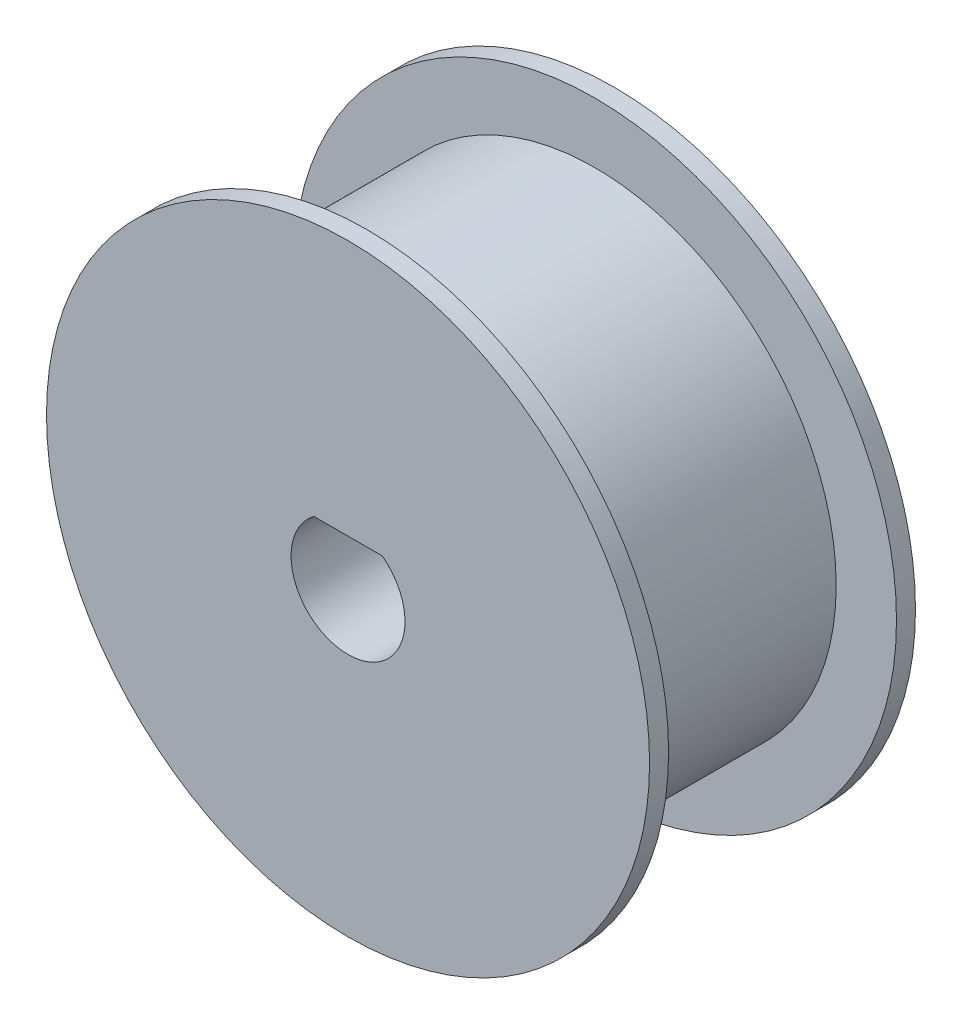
SolidWorks part; units mm, degrees
ref_plane "Front Plane" through (0, 0, 0) normal (0, 0, 1) x (1, 0, 0)
ref_plane "Top Plane" through (0, 0, 0) normal (0, 1, 0) x (1, 0, 0)
ref_plane "Right Plane" through (0, 0, 0) normal (1, 0, 0) x (0, 0, -1)
sketch "Sketch1" plane through (0, 0, 0) normal (0, 0, 1) x (1, 0, 0)
  circle A0 centre (0, 0) radius 3
  circle A1 centre (0, 0) radius 12.7
  dimension "D1" = 6
  dimension "D2" = 25.4
extrude "Boss-Extrude1" add sketch "Sketch1" along normal blind 12
sketch "Sketch2" plane through (0, 0, 12) normal (0, 0, 1) x (1, 0, 0)
  circle A0 centre (0, 0) radius 15.875
  circle A1 centre (0, 0) radius 3
  dimension "D1" = 31.75
  dimension "D2" = 6
extrude "Boss-Extrude2" add sketch "Sketch2" along normal blind 1
sketch "Sketch3" plane through (0, 0, 0) normal (0, 0, -1) x (-1, 0, 0)
  circle A0 centre (0, 0) radius 3
  circle A1 centre (0, 0) radius 15.875
  dimension "D1" = 6
  dimension "D2" = 31.75
extrude "Boss-Extrude3" add sketch "Sketch3" along normal blind 1
sketch "Sketch4" plane through (0, 0, 13) normal (0, 0, 1) x (1, 0, 0)
  line L0 (-1.8, 2.4) -> (1.8, 2.4)
  circle A1 centre (0, 0) radius 3 construction
  arc A2 (-1.8, 2.4) -> (1.8, 2.4) centre (0, 0) cw
  dimension "D1" = 3.6
extrude "Boss-Extrude4" add sketch "Sketch4" against normal up to surface (14 mm away)
